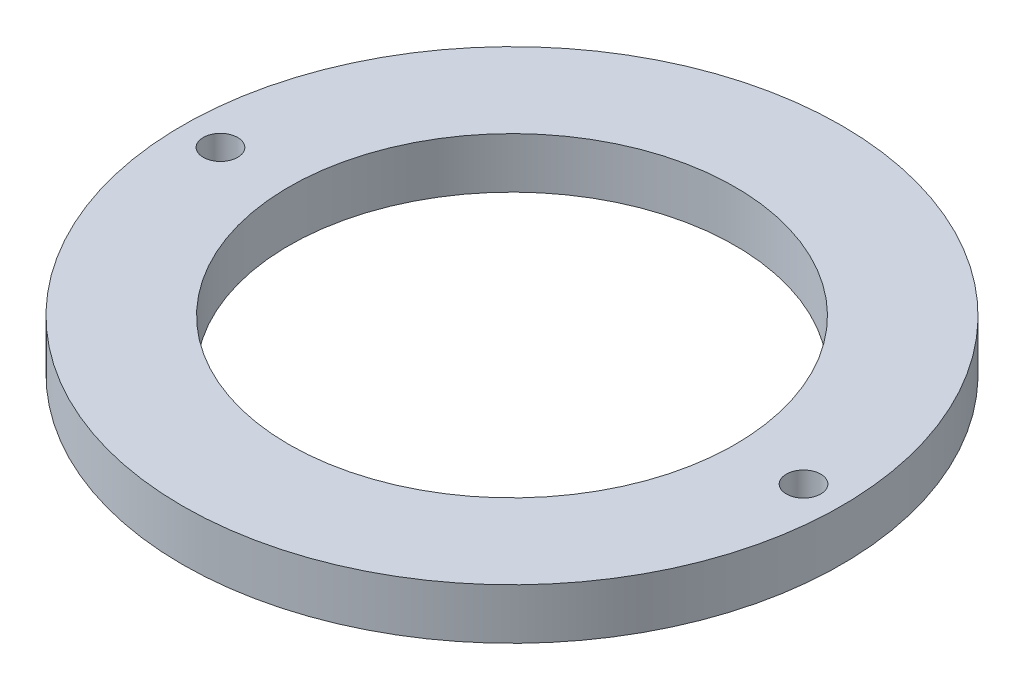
SolidWorks part; units mm, degrees
ref_plane "Plan de face" through (0, 0, 0) normal (0, 0, 1) x (1, 0, 0)
ref_plane "Plan de dessus" through (0, 0, 0) normal (0, 1, 0) x (1, 0, 0)
ref_plane "Plan de droite" through (0, 0, 0) normal (1, 0, 0) x (0, 0, -1)
sketch "Esquisse1" plane through (0, 0, 0) normal (0, 1, 0) x (1, 0, 0)
  line L0 (-57.5, 0) -> (57.5, 0) construction
  circle A0 centre (0, 0) radius 65
  circle A1 centre (0, 0) radius 44
  circle A2 centre (57.5, 0) radius 3.4
  circle A3 centre (-57.5, 0) radius 3.4
  dimension "D1" = 130
  dimension "D2" = 88
  dimension "D3" = 6.8
  dimension "D4" = 115
extrude "Extrusion1" add sketch "Esquisse1" along normal blind 10
